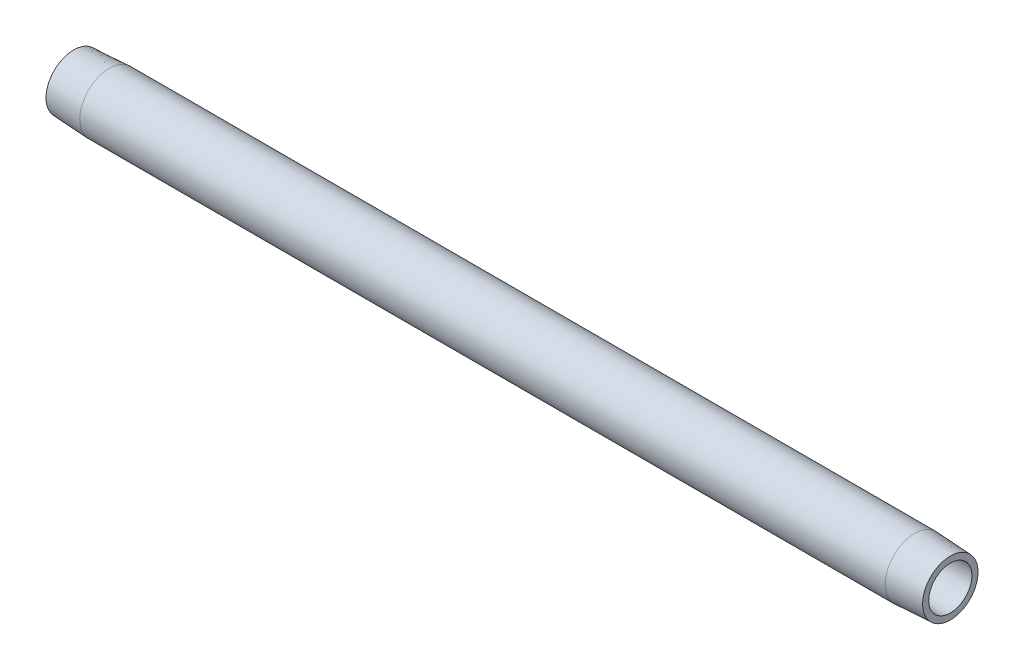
SolidWorks part; units mm, degrees
ref_plane "Front Plane" through (0, 0, 0) normal (0, 0, 1) x (1, 0, 0)
ref_plane "Top Plane" through (0, 0, 0) normal (0, 1, 0) x (1, 0, 0)
ref_plane "Right Plane" through (0, 0, 0) normal (1, 0, 0) x (0, 0, -1)
sketch "Sketch1" plane through (0, 0, 0) normal (0, 0, 1) x (1, 0, 0)
  line L5 (254, 6.2611) -> (0, 6.2611)
  line L6 (243.6876, 8.5725) -> (10.3124, 8.5725)
  line L7 (10.3124, 8.5725) -> (0, 8.0321)
  line L8 (254, 8.0321) -> (243.6876, 8.5725)
  line L9 (254, 6.2611) -> (254, 8.0321)
  line L10 (0, 6.2611) -> (0, 8.0321)
  line L11 (0, 0) -> (50000, 0) construction
  line L12 (0, -55) -> (0, 55) construction
  dimension "D1" = 12.5222
  dimension "D2" = 17.145
  dimension "D3" = 3
  dimension "D4" = 3
  dimension "D5" = 254
  dimension "D6" = 10.3124
  dimension "D7" = 10.3124
revolve "Revolve1" add sketch "Sketch1" angle 360 about L11
